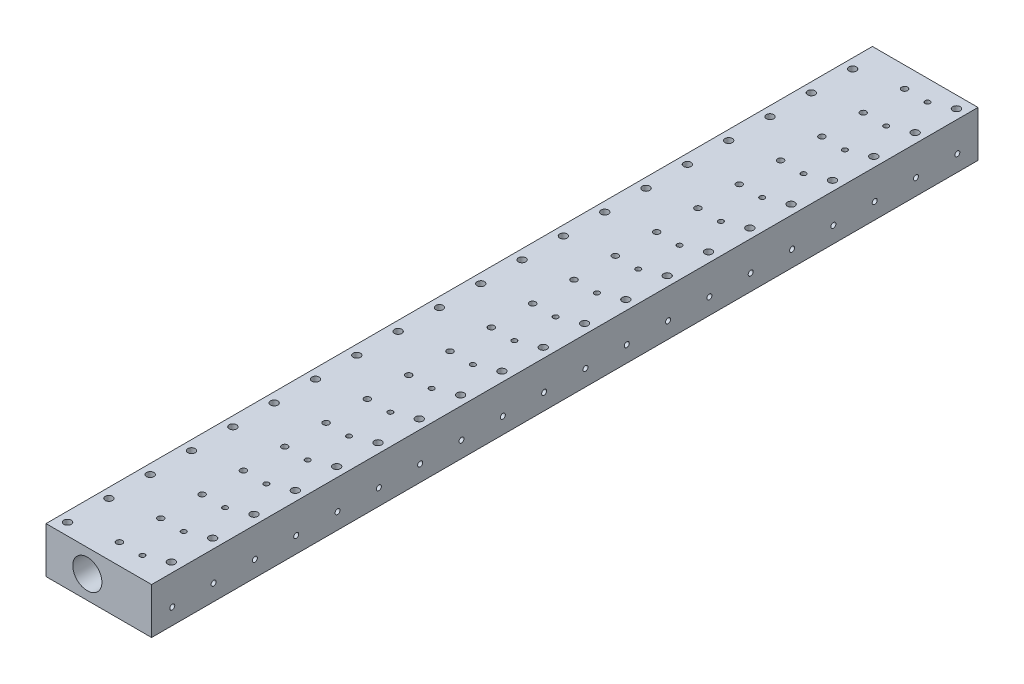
SolidWorks part; units mm, degrees
ref_plane "Front Plane" through (0, 0, 0) normal (0, 0, 1) x (1, 0, 0)
ref_plane "Top Plane" through (0, 0, 0) normal (0, 1, 0) x (1, 0, 0)
ref_plane "Right Plane" through (0, 0, 0) normal (1, 0, 0) x (0, 0, -1)
sketch "Sketch1" plane through (0, 0, 0) normal (0, 0, 1) x (1, 0, 0)
  line L1 (-11.5, -5) -> (11.5, -5)
  line L2 (-11.5, -5) -> (-11.5, 5)
  line L3 (-11.5, 5) -> (11.5, 5)
  line L4 (11.5, -5) -> (11.5, 5)
  line L5 (-11.5, -5) -> (11.5, 5) construction
  line L6 (-11.5, 5) -> (11.5, -5) construction
  point P0 (0, 0)
  dimension "D1" = 23
  dimension "D2" = 10
extrude "Boss-Extrude1" add sketch "Sketch1" against normal blind 180
hole_wizard "#55 (0.052) Diameter Hole1" positions "Sketch2" profile "Sketch4" hole size "#55" standard "ANSI Inch"
sketch "Sketch2" plane through (0, 5, 0) normal (0, 1, 0) x (1, 0, 0)
  line L0 (11.5, 0) -> (-11.5, 0) construction
  point P0 (0, 4.5)
  dimension "D1" = 4.5
sketch "Sketch4" plane through (0, 5, -4.5) normal (1, 0, 0) x (0, 0, 1)
  line L0 (0, 0) -> (0, 7.3968)
  line L1 (0, 7.3968) -> (0.6604, 7)
  line L2 (0.6604, 7) -> (0.6604, 0)
  line L5 (0.6604, 0) -> (0, 0)
  line L10 (0, 7.3968) -> (-0.6604, 7) construction
  line L11 (0, -6.35) -> (0, 107.95) construction
  dimension "Hole Dia." = 1.3208
  dimension "Hole Depth" = 7
  dimension "Drill Angle" = 118
sketch "Sketch5" plane through (0, 0, 0) normal (0, 0, 1) x (1, 0, 0)
  circle A0 centre (-2.5, 0) radius 3.175
  dimension "D2" = 6.35
  dimension "D1" = 2.5
extrude "Cut-Extrude1" cut sketch "Sketch5" against normal through all
hole_wizard "M2x0.4 Tapped Hole1" positions "Sketch6" profile "Sketch8" tap size "M2x0.4" standard "ANSI Metric"
sketch "Sketch6" plane through (0, 5, 0) normal (0, 1, 0) x (1, 0, 0)
  line L0 (0, 4.5) -> (5, 4.5) construction
  point P0 (9.4, 6.4)
  point P2 (-9.4, 2.6)
  dimension "D1" = 9.4
  dimension "D2" = 9.4
  dimension "D3" = 1.9
  dimension "D4" = 1.9
sketch "Sketch8" plane through (9.4, 5, -6.4) normal (1, 0, 0) x (0, 0, 1)
  line L0 (0, 0) -> (0, 5.6807)
  line L1 (0, 5.6807) -> (0.8, 5.2)
  line L2 (0.8, 5.2) -> (0.8, 0)
  line L5 (0.8, 0) -> (0, 0)
  line L10 (0, 5.6807) -> (-0.8, 5.2) construction
  line L11 (0, -6.35) -> (0, 107.95) construction
  dimension "Tap Drill Dia." = 1.6
  dimension "Tap Drill Depth" = 5.2
  dimension "Drill Angle" = 118
hole_wizard "#57 (0.043) Diameter Hole1" positions "Sketch11" profile "Sketch12" hole size "#57" standard "ANSI Inch"
sketch "Sketch11" plane through (11.5, 0, 0) normal (1, 0, 0) x (0, 0, -1)
  line L0 (0, -5) -> (0, 5) construction
  line L1 (180, 5) -> (0, 5) construction
  point P0 (4.5, -1.5)
  dimension "D1" = 4.5
  dimension "D2" = 6.5
sketch "Sketch12" plane through (11.5, -1.5, -4.5) normal (0, 1, 0) x (0, 0, -1)
  line L0 (0, 0) -> (0, 6.3281)
  line L1 (0, 6.3281) -> (0.5461, 6)
  line L2 (0.5461, 6) -> (0.5461, 0)
  line L5 (0.5461, 0) -> (0, 0)
  line L10 (0, 6.3281) -> (-0.5461, 6) construction
  line L11 (0, -6.35) -> (0, 107.95) construction
  dimension "Hole Dia." = 1.0922
  dimension "Hole Depth" = 6
  dimension "Drill Angle" = 118
hole_wizard "#57 (0.043) Diameter Hole2" positions "Sketch13" profile "Sketch14" hole size "#57" standard "ANSI Inch"
sketch "Sketch13" plane through (0, 5, 0) normal (0, 1, 0) x (1, 0, 0)
  line L0 (0, 4.5) -> (5, 4.5)
  point P0 (5, 4.5)
  dimension "D1" = 5
sketch "Sketch14" plane through (5, 5, -4.5) normal (1, 0, 0) x (0, 0, 1)
  line L0 (0, 0) -> (0, 7.8281)
  line L1 (0, 7.8281) -> (0.5461, 7.5)
  line L2 (0.5461, 7.5) -> (0.5461, 0)
  line L5 (0.5461, 0) -> (0, 0)
  line L10 (0, 7.8281) -> (-0.5461, 7.5) construction
  line L11 (0, -6.35) -> (0, 107.95) construction
  dimension "Hole Dia." = 1.0922
  dimension "Hole Depth" = 7.5
  dimension "Drill Angle" = 118
pattern_linear "LPattern1" count 20 spacing 9 along (0, 0, -1) of "#55 (0.052) Diameter Hole1", "M2x0.4 Tapped Hole1", "#57 (0.043) Diameter Hole1", "#57 (0.043) Diameter Hole2"
